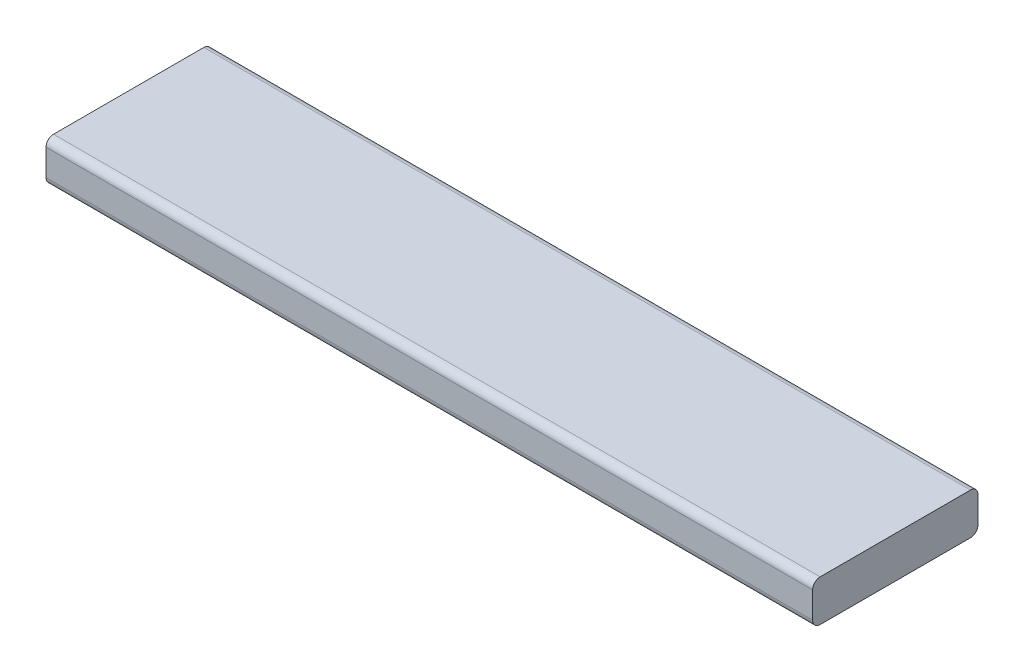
SolidWorks part; units mm, degrees
ref_plane "Bottom Plane" through (0, 0, 0) normal (0, 0, 1) x (1, 0, 0)
ref_plane "Front Plane" through (0, 0, 0) normal (0, 1, 0) x (1, 0, 0)
ref_plane "Left Plane" through (0, 0, 0) normal (1, 0, 0) x (0, 0, -1)
ref_plane "Right Plane" through (647.7, 0, 0) normal (1, 0, 0) x (0, 0, -1)
ref_plane "Back Plane" through (0, 19.05, 0) normal (0, 1, 0) x (1, 0, 0)
ref_plane "Top Plane" through (0, 0, 139.7) normal (0, 0, 1) x (1, 0, 0)
sketch "Sketch2" plane through (0, 0, 0) normal (1, 0, 0) x (0, 0, -1)
  line L1 (0, 0) -> (-139.7, 0)
  line L2 (0, 0) -> (0, 34.925)
  line L3 (0, 34.925) -> (-139.7, 34.925)
  line L4 (-139.7, 0) -> (-139.7, 34.925)
  dimension "D1" = 34.925
  dimension "D2" = 139.7
extrude "Boss-Extrude1" add sketch "Sketch2" along normal up to surface (647.7 mm away)
ref_plane "half length" through (323.85, 0, 0) normal (1, 0, 0) x (0, 0, -1)
ref_plane "Half Width" through (0, 0, 69.85) normal (0, 0, 1) x (1, 0, 0)
fillet "Fillet1" radius 6.35 4 edges at (323.85, 34.925, 139.7) (323.85, 34.925, 0) (323.85, 0, 0) (323.85, 0, 139.7)
